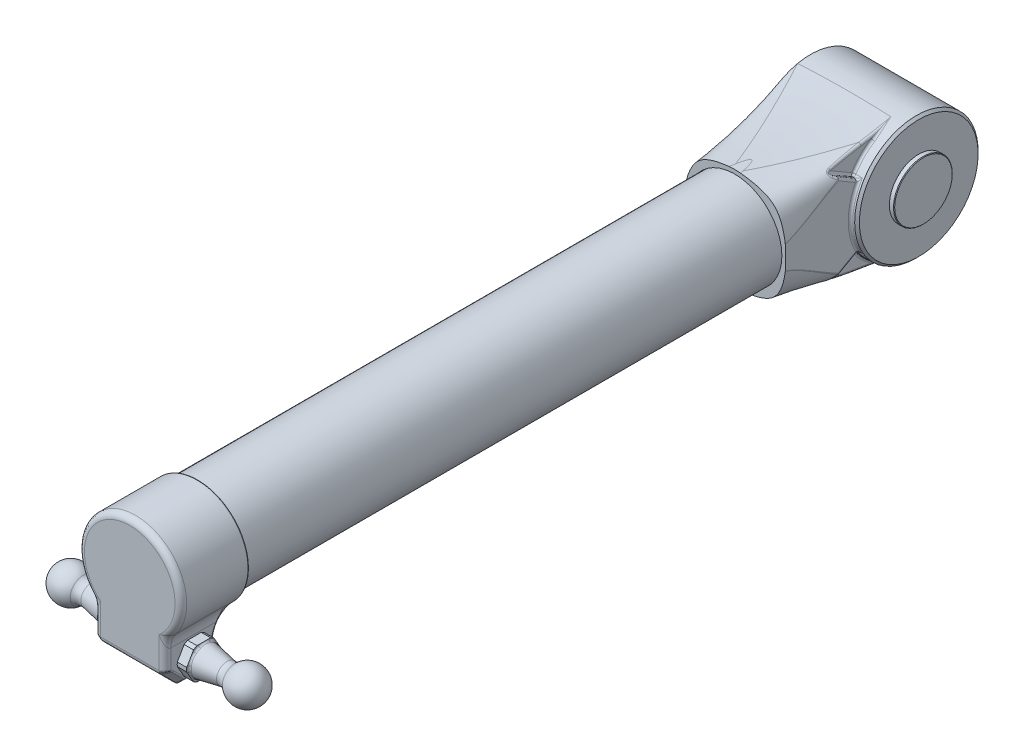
SolidWorks part; units mm, degrees
ref_plane "前视基准面" through (0, 0, 0) normal (0, 0, 1) x (1, 0, 0)
ref_plane "上视基准面" through (0, 0, 0) normal (0, 1, 0) x (1, 0, 0)
ref_plane "右视基准面" through (0, 0, 0) normal (1, 0, 0) x (0, 0, -1)
imported_body "1-SP0389-23112701-1-solid1"
imported_body "1-SP0389-23112706-1-solid1"
imported_body "1-SP0389-23112702-1-solid1"
imported_body "1-AP083S-01-01-05-1-solid1"
imported_body "1-079-000342-1-solid1"
imported_body "1-SP0389-23112504-1-solid1"
imported_body "1-SP0389-23112504-2-solid1"
imported_body "1-SP0389-23112703-1-solid1"
imported_body "1-SP0389-23112703-2-solid1"
imported_body "1-079-000345-1-solid1"
sketch "草图1" plane through (48.5, 0, 0) normal (1, 0, 0) x (0, 0, -1)
  circle A0 centre (56.0651, 0) radius 50.5 construction
  circle A1 centre (56.0651, 0) radius 50.5
extrude "凸台-拉伸1" add sketch "草图1" against normal up to surface (86.5 mm away)
